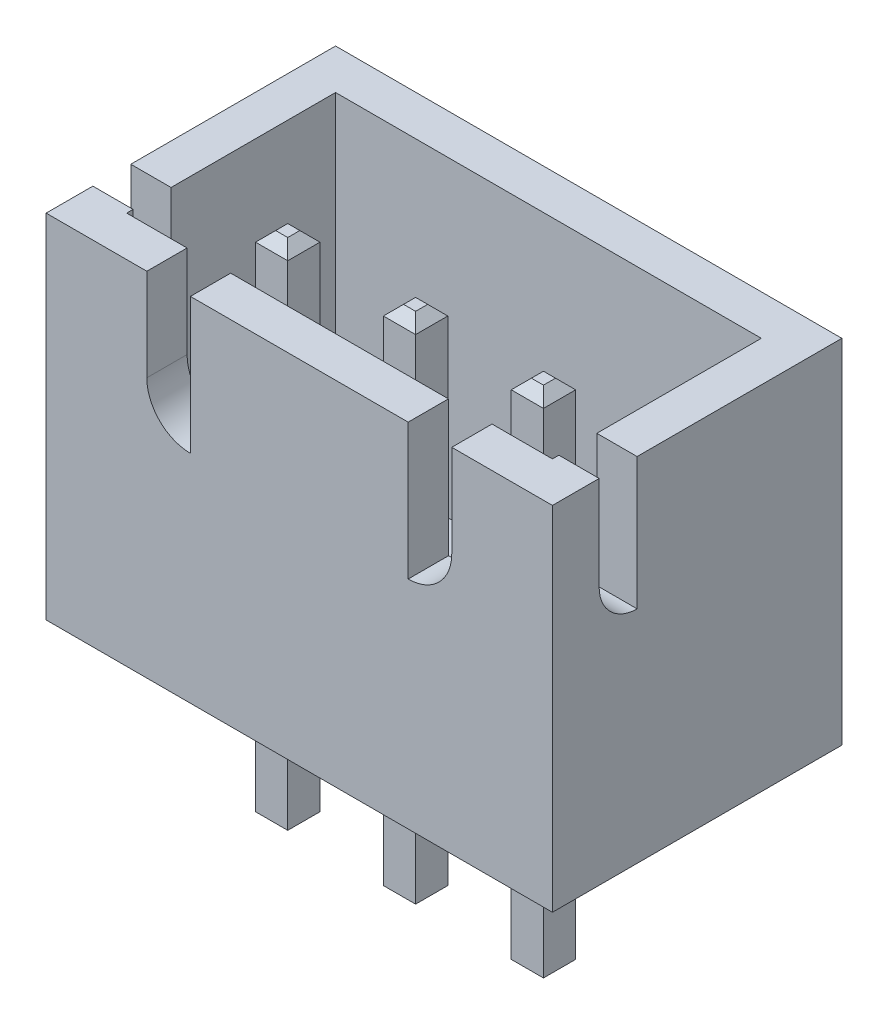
SolidWorks part; units mm, degrees
other "Camera1"
ref_plane "Front Plane" through (0, 0, 0) normal (0, 0, 1) x (1, 0, 0)
ref_plane "Top Plane" through (0, 0, 0) normal (0, 1, 0) x (1, 0, 0)
ref_plane "Right Plane" through (0, 0, 0) normal (1, 0, 0) x (0, 0, -1)
sketch "Sketch1" plane through (0, 0, 0) normal (0, 1, 0) x (1, 0, 0)
  line L1 (-5.0292, 2.875) -> (5.0292, 2.875)
  line L2 (-5.0292, 2.875) -> (-5.0292, -2.875)
  line L3 (-5.0292, -2.875) -> (5.0292, -2.875)
  line L4 (5.0292, 2.875) -> (5.0292, -2.875)
  line L5 (-5.0292, 2.875) -> (5.0292, -2.875) construction
  line L6 (-5.0292, -2.875) -> (5.0292, 2.875) construction
  point P0 (0, 0)
  dimension "D1" = 5.75
  dimension "D2" = 10.0584
extrude "Boss-Extrude1" add sketch "Sketch1" along normal blind 7
shell "Shell1" thickness 0.8
sketch "Sketch2" plane through (5.0292, 0, 0) normal (1, 0, 0) x (0, 0, -1)
  line L0 (-1.193, 7) -> (-1.193, 4.3796)
  line L1 (-2.875, 7) -> (2.875, 7) construction
  line L2 (-1.9469, 5.1335) -> (-1.9469, 7)
  line L3 (-1.9469, 7) -> (-1.193, 7)
  arc A0 (-1.193, 4.3796) -> (-1.9469, 5.1335) centre (-1.193, 5.1335) cw
extrude "Cut-Extrude1" cut sketch "Sketch2" against normal through all
sketch "Sketch3" plane through (0, 0, 2.875) normal (0, 0, 1) x (1, 0, 0)
  line L0 (-3.0292, 7) -> (-3.0292, 6.7289)
  line L1 (-5.0292, 7) -> (5.0292, 7) construction
  line L4 (-3.0292, 6.7289) -> (-3.0292, 5.1663)
  line L5 (-2.163, 4.3001) -> (-2.163, 7)
  line L6 (-2.163, 7) -> (-3.0292, 7)
  line L7 (-5.0292, 7) -> (-5.0292, 0) construction
  line L8 (0, 7) -> (0, 0) construction
  line L9 (2.163, 7) -> (3.0292, 7)
  line L10 (2.163, 4.3001) -> (2.163, 7)
  line L11 (3.0292, 6.7289) -> (3.0292, 5.1663)
  line L14 (3.0292, 7) -> (3.0292, 6.7289)
  arc A0 (-3.0292, 5.1663) -> (-2.163, 4.3001) centre (-2.163, 5.1663) ccw
  arc A1 (3.0292, 5.1663) -> (2.163, 4.3001) centre (2.163, 5.1663) cw
  dimension "D1" = 2
extrude "Cut-Extrude2" cut sketch "Sketch3" against normal up to next
sketch "Sketch4" plane through (0, 0, 0) normal (0, -1, 0) x (1, 0, 0)
  line L0 (-5.0292, -2.875) -> (-5.0292, 2.875) construction
  line L1 (-2.8992, 0.845) -> (-2.2592, 0.845)
  line L2 (-2.8992, 0.845) -> (-2.8992, 0.205)
  line L3 (-2.8992, 0.205) -> (-2.2592, 0.205)
  line L4 (-2.2592, 0.845) -> (-2.2592, 0.205)
  line L5 (-2.8992, 0.845) -> (-2.2592, 0.205) construction
  line L6 (-2.8992, 0.205) -> (-2.2592, 0.845) construction
  line L9 (-5.0292, 2.875) -> (5.0292, 2.875) construction
  line L10 (-0.3592, 0.845) -> (0.2808, 0.845)
  line L11 (0.2808, 0.845) -> (0.2808, 0.205)
  line L12 (-0.3592, 0.205) -> (0.2808, 0.205)
  line L13 (-0.3592, 0.845) -> (-0.3592, 0.205)
  line L14 (2.1808, 0.845) -> (2.8208, 0.845)
  line L15 (2.8208, 0.845) -> (2.8208, 0.205)
  line L16 (2.1808, 0.205) -> (2.8208, 0.205)
  line L17 (2.1808, 0.845) -> (2.1808, 0.205)
  line L22 (4.7208, 0.845) -> (5.3608, 0.845)
  line L23 (5.3608, 0.845) -> (5.3608, 0.205)
  line L24 (4.7208, 0.205) -> (5.3608, 0.205)
  line L25 (4.7208, 0.845) -> (4.7208, 0.205)
  point P0 (-2.5792, 0.525)
  dimension "D1" = 0.64
  dimension "D2" = 0.64
  dimension "D3" = 2.45
  dimension "D4" = 2.35
  dimension "D5" = 4
extrude "Boss-Extrude2" add sketch "Sketch4" along normal blind 3.45 and the other way blind 6.75
chamfer "Chamfer1" distance 0.2 angle 45 24 edges at (2.1808, -3.45, 0.525) (2.5008, -3.45, 0.845) (2.8208, -3.45, 0.525) (2.5008, -3.45, 0.205) (-0.3592, -3.45, 0.525) (-0.0392, -3.45, 0.845) (0.2808, -3.45, 0.525) (-0.0392, -3.45, 0.205) (-2.5792, -3.45, 0.205) (-2.8992, -3.45, 0.525) (-2.5792, -3.45, 0.845) (-2.2592, -3.45, 0.525) (2.8208, 6.75, 0.525) (2.5008, 6.75, 0.845) (2.1808, 6.75, 0.525) (2.5008, 6.75, 0.205) (0.2808, 6.75, 0.525) (-0.0392, 6.75, 0.845) (-0.3592, 6.75, 0.525) (-0.0392, 6.75, 0.205) (-2.5792, 6.75, 0.845) (-2.8992, 6.75, 0.525) (-2.5792, 6.75, 0.205) (-2.2592, 6.75, 0.525)
